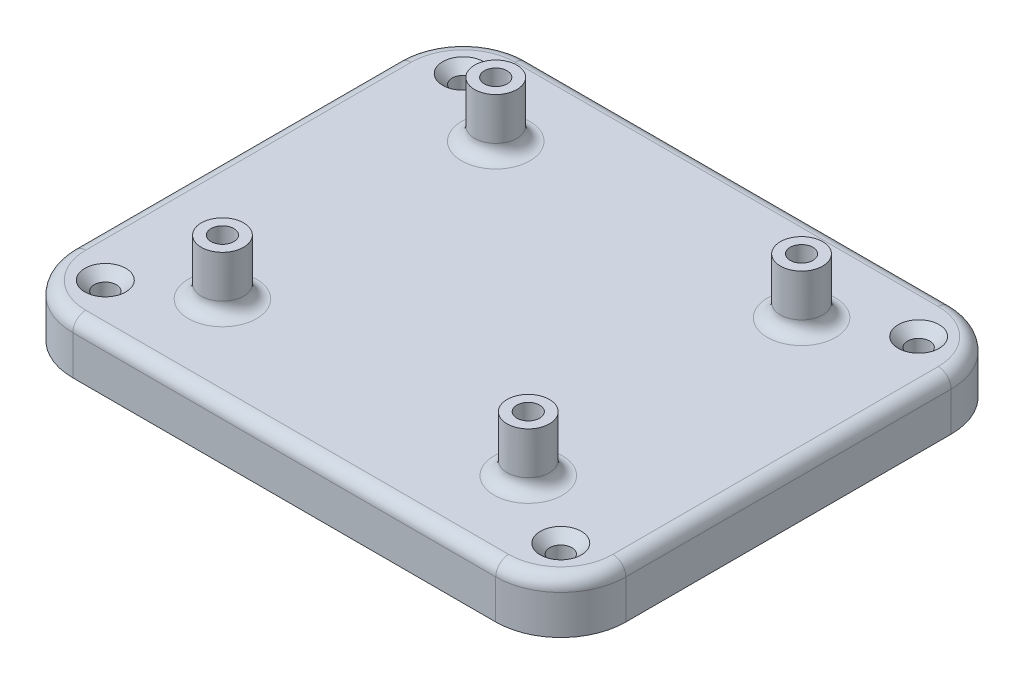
SolidWorks part; units mm, degrees
ref_plane "Front Plane" through (0, 0, 0) normal (0, 0, 1) x (1, 0, 0)
ref_plane "Top Plane" through (0, 0, 0) normal (0, 1, 0) x (1, 0, 0)
ref_plane "Right Plane" through (0, 0, 0) normal (1, 0, 0) x (0, 0, -1)
sketch "Sketch1" plane through (0, 0, 0) normal (0, 1, 0) x (1, 0, 0)
  line L1 (-42.5, -35) -> (42.5, -35)
  line L2 (-42.5, -35) -> (-42.5, 35)
  line L3 (-42.5, 35) -> (42.5, 35)
  line L4 (42.5, -35) -> (42.5, 35)
  line L5 (-42.5, -35) -> (42.5, 35) construction
  line L6 (-42.5, 35) -> (42.5, -35) construction
  point P0 (0, 0)
  dimension "D1" = 85
  dimension "D2" = 70
extrude "Boss-Extrude1" add sketch "Sketch1" along normal mid plane 8
sketch "Sketch2" plane through (0, 4, 0) normal (0, 1, 0) x (1, 0, 0)
  circle A0 centre (-23.5, 21) radius 3.25
  circle A1 centre (23.5, 21) radius 3.25
  circle A2 centre (23.5, -21) radius 3.25
  circle A3 centre (-23.5, -21) radius 3.25
  point P0 (0, 0)
  dimension "D3" = 6.5
  dimension "D4" = 6.5
  dimension "D5" = 6.5
  dimension "D6" = 6.5
  dimension "D1" = 47
  dimension "D2" = 42
extrude "Boss-Extrude2" add sketch "Sketch2" along normal blind 8.5
sketch "Sketch4" plane through (0, 12.5, 0) normal (0, 1, 0) x (1, 0, 0)
  circle A0 centre (-23.5, -21) radius 1.75
  circle A1 centre (-23.5, 21) radius 1.75
  circle A2 centre (23.5, 21) radius 1.75
  circle A3 centre (23.5, -21) radius 1.75
  dimension "D1" = 3.5
  dimension "D2" = 3.5
  dimension "D3" = 3.5
  dimension "D4" = 3.5
extrude "Cut-Extrude1" cut sketch "Sketch4" against normal through all
sketch "Sketch5" plane through (0, 4, 0) normal (0, 1, 0) x (1, 0, 0)
  line L1 (-35, -27.5) -> (35, -27.5)
  line L2 (-35, -27.5) -> (-35, 27.5)
  line L3 (-35, 27.5) -> (35, 27.5)
  line L4 (35, -27.5) -> (35, 27.5)
  line L5 (-35, -27.5) -> (35, 27.5) construction
  line L6 (-35, 27.5) -> (35, -27.5) construction
  point P0 (0, 0)
  dimension "D1" = 55
  dimension "D2" = 70
hole_wizard "CSK for M3 Countersunk Flat Head Screw1" positions "Sketch6" profile "Sketch7" countersink size "M3" standard "ISO"
sketch "Sketch6" plane through (0, 4, 0) normal (0, 1, 0) x (1, 0, 0)
  point P0 (-35, 27.5)
  point P3 (35, 27.5)
  point P6 (35, -27.5)
  point P9 (-35, -27.5)
sketch "Sketch7" plane through (-35, 4, -27.5) normal (1, 0, 0) x (0, 0, 1)
  line L0 (0, 0) -> (0, 8)
  line L1 (0, 8) -> (1.7, 8)
  line L2 (1.7, 8) -> (1.7, 1.45)
  line L3 (1.7, 1.45) -> (3.15, 0)
  line L5 (3.15, 0) -> (0, 0)
  line L6 (-1.7, 1.45) -> (-3.15, 0) construction
  line L11 (0, -6.35) -> (0, 107.95) construction
  dimension "Thru Hole Dia." = 3.4
  dimension "Thru Hole Depth" = 8
  dimension "Near C'Sink Dia." = 6.3
  dimension "Near C'Sink Angle" = 90
fillet "Fillet1" radius 2 4 edges at (23.5, 4, -24.25) (23.5, 4, 17.75) (-23.5, 4, -24.25) (-23.5, 4, 17.75)
fillet "Fillet2" radius 10 4 edges at (-42.5, 0, -35) (42.5, 0, -35) (42.5, 0, 35) (-42.5, 0, 35)
fillet "Fillet3" radius 2 8 edges at (39.5711, 4, 32.0711) (0, 4, 35) (-39.5711, 4, 32.0711) (-42.5, 4, 0) (-39.5711, 4, -32.0711) (0, 4, -35) (39.5711, 4, -32.0711) (42.5, 4, 0)
sketch "Sketch9" plane through (0, -4, 0) normal (0, -1, 0) x (-1, 0, 0)
  line L1 (20.4778, -20.0254) -> (21.1449, -23.1299)
  line L2 (21.1449, -23.1299) -> (24.167, -24.1046)
  line L3 (24.167, -24.1046) -> (26.5222, -21.9746)
  line L4 (26.5222, -21.9746) -> (25.8551, -18.8701)
  line L5 (25.8551, -18.8701) -> (22.833, -17.8954)
  line L6 (22.833, -17.8954) -> (20.4778, -20.0254)
  line L7 (-26.6754, -21) -> (-25.0877, -23.75)
  line L8 (-25.0877, -23.75) -> (-21.9123, -23.75)
  line L9 (-21.9123, -23.75) -> (-20.3246, -21)
  line L10 (-20.3246, -21) -> (-21.9123, -18.25)
  line L11 (-21.9123, -18.25) -> (-25.0877, -18.25)
  line L12 (-25.0877, -18.25) -> (-26.6754, -21)
  line L13 (-25.8585, 18.8738) -> (-22.8379, 17.8944)
  line L14 (-22.8379, 17.8944) -> (-20.4794, 20.0206)
  line L15 (-20.4794, 20.0206) -> (-21.1415, 23.1262)
  line L16 (-21.1415, 23.1262) -> (-24.1621, 24.1056)
  line L17 (-24.1621, 24.1056) -> (-26.5206, 21.9794)
  line L18 (-26.5206, 21.9794) -> (-25.8585, 18.8738)
  line L19 (20.9715, 19.0791) -> (23.8993, 17.8498)
  line L20 (23.8993, 17.8498) -> (26.4278, 19.7707)
  line L21 (26.4278, 19.7707) -> (26.0285, 22.9209)
  line L22 (26.0285, 22.9209) -> (23.1007, 24.1502)
  line L23 (23.1007, 24.1502) -> (20.5722, 22.2293)
  line L24 (20.5722, 22.2293) -> (20.9715, 19.0791)
  circle A0 centre (23.5, -21) radius 2.75 construction
  circle A1 centre (-23.5, -21) radius 2.75 construction
  circle A2 centre (-23.5, 21) radius 2.75 construction
  circle A3 centre (23.5, 21) radius 2.75 construction
extrude "Cut-Extrude2" cut sketch "Sketch9" against normal blind 4
